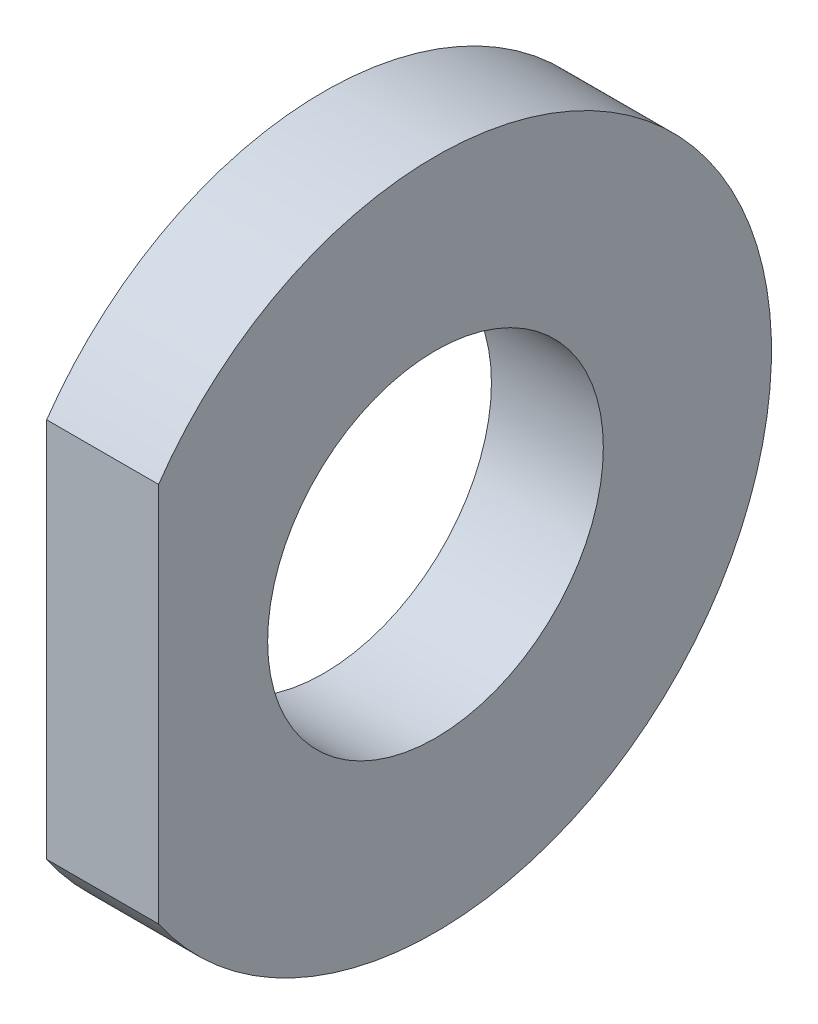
SolidWorks part; units mm, degrees
ref_plane "Plane1" through (0, 0, 0) normal (0, 0, 1) x (1, 0, 0)
ref_plane "Plane2" through (0, 0, 0) normal (0, 1, 0) x (1, 0, 0)
ref_plane "Plane3" through (0, 0, 0) normal (1, 0, 0) x (0, 0, -1)
sketch "Sketch1" plane through (0, 0, 0) normal (0, 0, 1) x (1, 0, 0)
  line L0 (0, 0) -> (-16.9314, 0) construction
  line L2 (0, 6.7437) -> (-4.4958, 6.7437)
  line L3 (0, 6.7437) -> (0, 13.5001)
  line L4 (0, 13.5001) -> (-4.4958, 13.5001)
  line L5 (-4.4958, 6.7437) -> (-4.4958, 13.5001)
  dimension "Outside_dia" = 27.0002
  dimension "Thickness" = 4.4958
  dimension "Inside_dia" = 13.4874
revolve "Revolve1" add sketch "Sketch1" angle 360 about L0
ref_plane "CutPlane" through (0, 0, 11.1252) normal (0, 0, 1) x (1, 0, 0)
other "SurfaceCut1"
